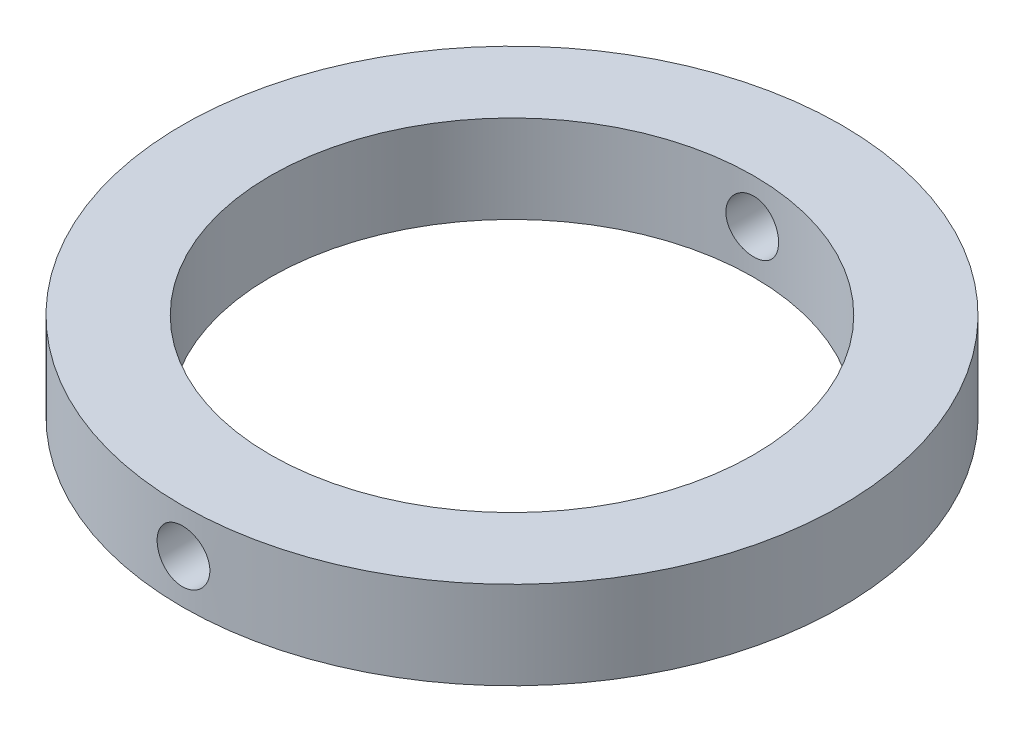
SolidWorks part; units mm, degrees
ref_plane "Front Plane" through (0, 0, 0) normal (0, 0, 1) x (1, 0, 0)
ref_plane "Top Plane" through (0, 0, 0) normal (0, 1, 0) x (1, 0, 0)
ref_plane "Right Plane" through (0, 0, 0) normal (1, 0, 0) x (0, 0, -1)
sketch "Sketch1" plane through (0, 0, 0) normal (0, 1, 0) x (1, 0, 0)
  circle A0 centre (0, 0) radius 27.5
  circle A1 centre (0, 0) radius 37.5
  dimension "D1" = 55
  dimension "D2" = 75
extrude "Boss-Extrude1" add sketch "Sketch1" along normal blind 10
sketch "Sketch2" plane through (0, 0, 0) normal (0, 0, 1) x (1, 0, 0)
  circle A0 centre (0, 5) radius 3
  dimension "D1" = 6
extrude "Cut-Extrude1" cut sketch "Sketch2" against normal mid plane 105
